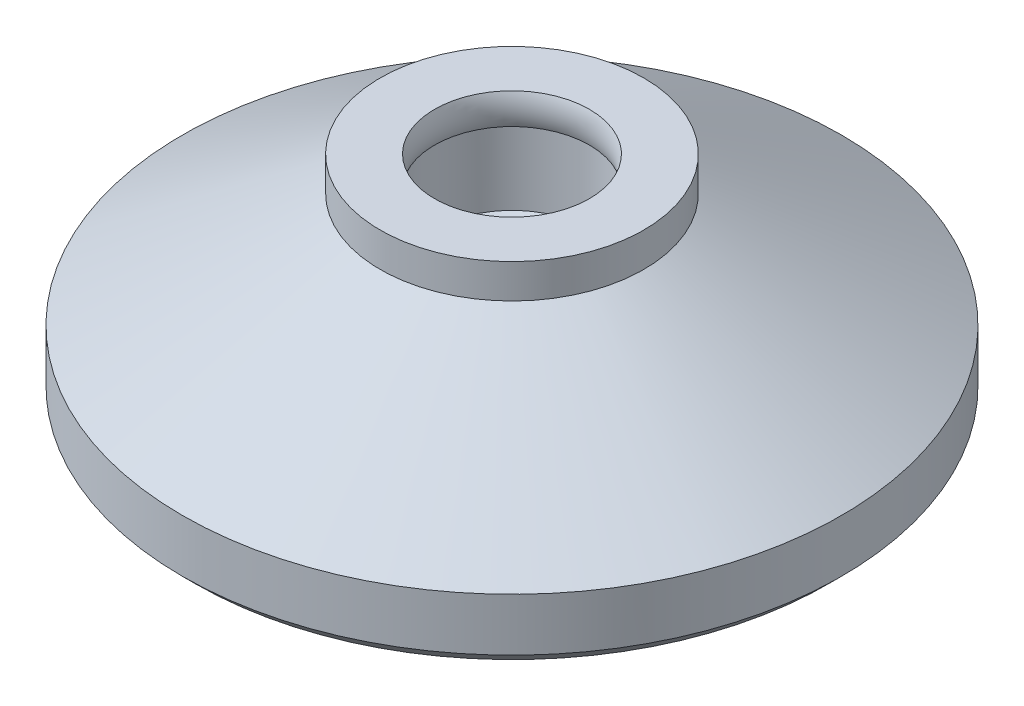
SolidWorks part; units mm, degrees
ref_plane "Front Plane" through (0, 0, 0) normal (0, 0, 1) x (1, 0, 0)
ref_plane "Top Plane" through (0, 0, 0) normal (0, 1, 0) x (1, 0, 0)
ref_plane "Right Plane" through (0, 0, 0) normal (1, 0, 0) x (0, 0, -1)
sketch "Sketch1" plane through (0, 0, 0) normal (0, 1, 0) x (1, 0, 0)
  circle A0 centre (0, 0) radius 8
  dimension "D1" = 16
extrude "Extrude1" add sketch "Sketch1" along normal mid plane 13
sketch "Sketch3" plane through (0, -6.5, 0) normal (0, -1, 0) x (1, 0, 0)
  circle A0 centre (0, 0) radius 20
  dimension "D1" = 40
extrude "Extrude2" add sketch "Sketch3" against normal blind 4
sketch "Sketch4" plane through (0, 0, 0) normal (0, 0, 1) x (1, 0, 0)
  line L0 (-20, -2.5) -> (-8, 4.4282)
  line L1 (-8, 6.5) -> (-8, -2.5) construction
  line L2 (-8, 4.4282) -> (-8, -2.5)
  line L3 (-8, -2.5) -> (-20, -2.5)
  dimension "D1" = 30
revolve "Revolve1" add sketch "Sketch4" angle 360 about axis through (0, 6.5, 0) along (0, -1, 0)
chamfer "Chamfer1" distance 0.8 angle 45 1 edges at (0, -6.5, -20)
sketch "Sketch5" plane through (0, 0, 0) normal (0, 0, 1) x (1, 0, 0)
  line L1 (0, 0) -> (0, 11.3083) construction
  line L2 (0, 6.5) -> (4.7, 6.5)
  line L3 (8, 6.5) -> (-8, 6.5) construction
  line L4 (4.7, 4.62) -> (4.7, 0.2135)
  line L5 (4.7, 0.2135) -> (0, -2.5)
  line L6 (0, -2.5) -> (0, 6.5)
  line L7 (20, -2.5) -> (-20, -2.5) construction
  arc A0 (4.7, 6.5) -> (4.7, 4.62) centre (6.956, 5.56) ccw
  point P14 (4.512, 5.56)
  dimension "D2" = 9.4
  dimension "D1" = 60
  dimension "D3" = 1.88
  dimension "D4" = 0.188
revolve "Cut-Revolve1" cut sketch "Sketch5" angle 360 about L1
equation "\"D3@Sketch5\" = \"D2@Sketch5\"*0.2"
equation "\"D4@Sketch5\" = \"D3@Sketch5\"*0.1"
